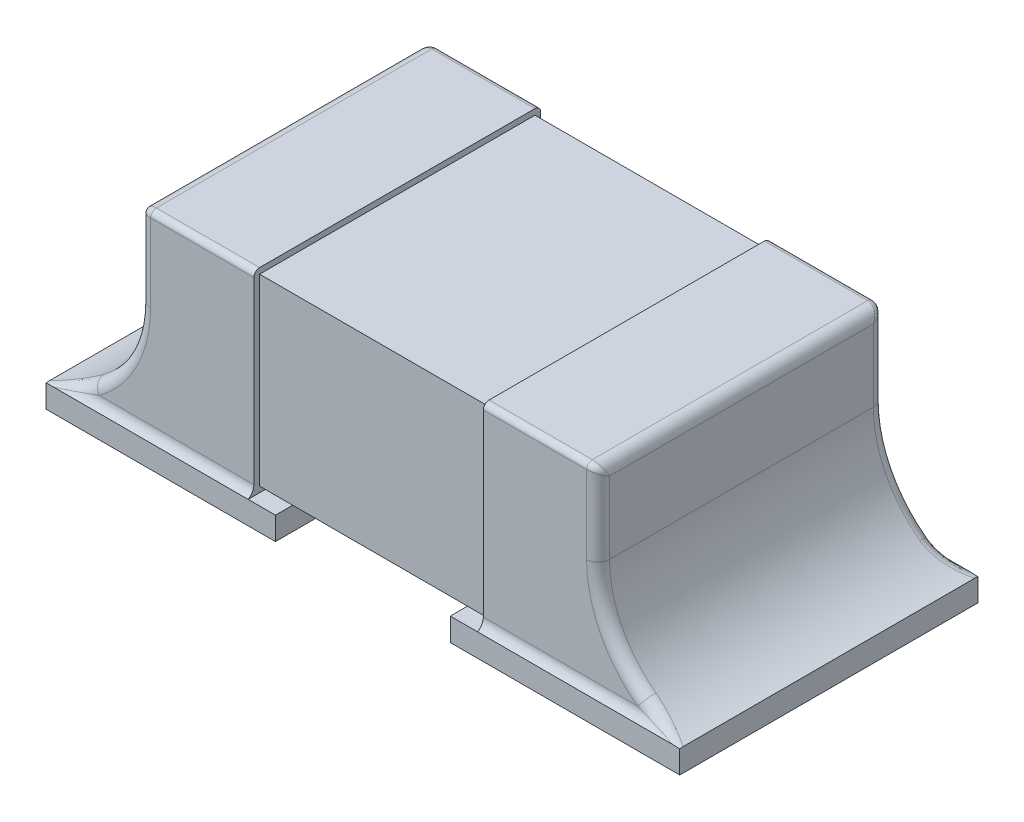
SolidWorks part; units mm, degrees
ref_plane "Front Plane" through (0, 0, 0) normal (0, 0, 1) x (1, 0, 0)
ref_plane "Top Plane" through (0, 0, 0) normal (0, 1, 0) x (1, 0, 0)
ref_plane "Right Plane" through (0, 0, 0) normal (1, 0, 0) x (0, 0, -1)
sketch "Sketch1" plane through (0, 0, 0) normal (1, 0, 0) x (0, 0, -1)
  line L0 (0.7489, 0) -> (-0.7489, 0) construction
  line L1 (-0.6, 0.125) -> (0.6, 0.125)
  line L2 (-0.6, 0.125) -> (-0.6, 0.925)
  line L3 (-0.6, 0.925) -> (0.6, 0.925)
  line L4 (0.6, 0.125) -> (0.6, 0.925)
  line L5 (0, 0.5225) -> (0, -0.5225) construction
  dimension "D1" = 1.2
  dimension "D2" = 0.8
  dimension "D3" = 0.125
  dimension "D4" = 0.6
extrude "Boss-Extrude1" add sketch "Sketch1" along normal mid plane 1
sketch "Sketch3" plane through (0.5, 0, 0) normal (1, 0, 0) x (0, 0, -1)
  line L0 (0, 0.5225) -> (0, -0.5225) construction
  line L1 (-0.6, 0.95) -> (0.6, 0.95)
  line L2 (-0.625, 0.925) -> (-0.625, 0.1)
  line L3 (-0.625, 0.1) -> (0.625, 0.1)
  line L4 (0.625, 0.925) -> (0.625, 0.1)
  line L6 (0.7489, 0) -> (-0.7489, 0) construction
  arc A2 (0.6, 0.95) -> (0.625, 0.925) centre (0.6, 0.925) cw
  arc A3 (-0.6, 0.95) -> (-0.625, 0.925) centre (-0.6, 0.925) ccw
  point P15 (0.625, 0.95)
  point P18 (-0.625, 0.95)
  dimension "D5" = 0.025
  dimension "D1" = 1.25
  dimension "D2" = 0.625
  dimension "D3" = 0.85
  dimension "D4" = 0.1
extrude "Boss-Extrude2" add sketch "Sketch3" along normal blind 0.5
sketch "Sketch5" plane through (-0.5, 0, 0) normal (-1, 0, 0) x (0, 0, 1)
  line L0 (0.6, 0.95) -> (-0.6, 0.95) construction
  line L1 (-0.6, 0.95) -> (0.6, 0.95)
  line L2 (-0.625, 0.925) -> (-0.625, 0.1)
  line L3 (-0.625, 0.1) -> (0.625, 0.1)
  line L4 (0.625, 0.925) -> (0.625, 0.1)
  line L5 (0.625, 0.925) -> (0.625, 0.1) construction
  line L6 (0.625, 0.1) -> (-0.625, 0.1) construction
  line L7 (-0.625, 0.925) -> (-0.625, 0.1) construction
  arc A2 (0.6, 0.95) -> (0.625, 0.925) centre (0.6, 0.925) cw
  arc A3 (-0.6, 0.95) -> (-0.625, 0.925) centre (-0.6, 0.925) ccw
  dimension "D1" = 0.025
extrude "Boss-Extrude3" add sketch "Sketch5" along normal blind 0.5
sketch "Sketch6" plane through (0, 0, 0) normal (0, 1, 0) x (1, 0, 0)
  line L0 (0, -0.5225) -> (0, 0.5225) construction
  line L1 (-1.381, 0.65) -> (-0.381, 0.65)
  line L2 (-1.381, 0.65) -> (-1.381, -0.65)
  line L3 (-1.381, -0.65) -> (-0.381, -0.65)
  line L4 (-0.381, 0.65) -> (-0.381, -0.65)
  line L5 (-0.5225, 0) -> (0.5225, 0) construction
  line L7 (0.381, 0.65) -> (1.381, 0.65)
  line L8 (0.381, 0.65) -> (0.381, -0.65)
  line L9 (0.381, -0.65) -> (1.381, -0.65)
  line L10 (1.381, 0.65) -> (1.381, -0.65)
  dimension "D1" = 1
  dimension "D2" = 1.3
  dimension "D3" = 0.381
  dimension "D4" = 0.65
  dimension "D5" = 0.381
extrude "Boss-Extrude4" add sketch "Sketch6" along normal blind 0.1
fillet "Fillet5" radius 0.05 4 edges at (0.75, 0.1, 0.625) (-0.75, 0.1, 0.625) (0.75, 0.1, -0.625) (-0.75, 0.1, -0.625)
fillet "Fillet7" radius 0.5 2 edges at (-1, 0.1, 0) (1, 0.1, 0)
fillet "Fillet8" radius 0.05 18 edges at (1.344, 0.1106, -0.6372) (1.0719, 0.3273, -0.625) (1.2939, 0.1301, 0.6268) (1.0719, 0.3273, 0.625) (1, 0.7553, 0.625) (1, 0.9427, 0.6177) (1, 0.95, 0) (1, 0.9427, -0.6177) (-1.344, 0.1106, 0.6372) (-1.0719, 0.3273, 0.625) (-1, 0.7553, 0.625) (-1, 0.9427, 0.6177) (-1, 0.95, 0) (-1, 0.9427, -0.6177) (-1.2939, 0.1301, -0.6268) (-1.0719, 0.3273, -0.625) (1, 0.7553, -0.625) (-1, 0.7553, -0.625)
